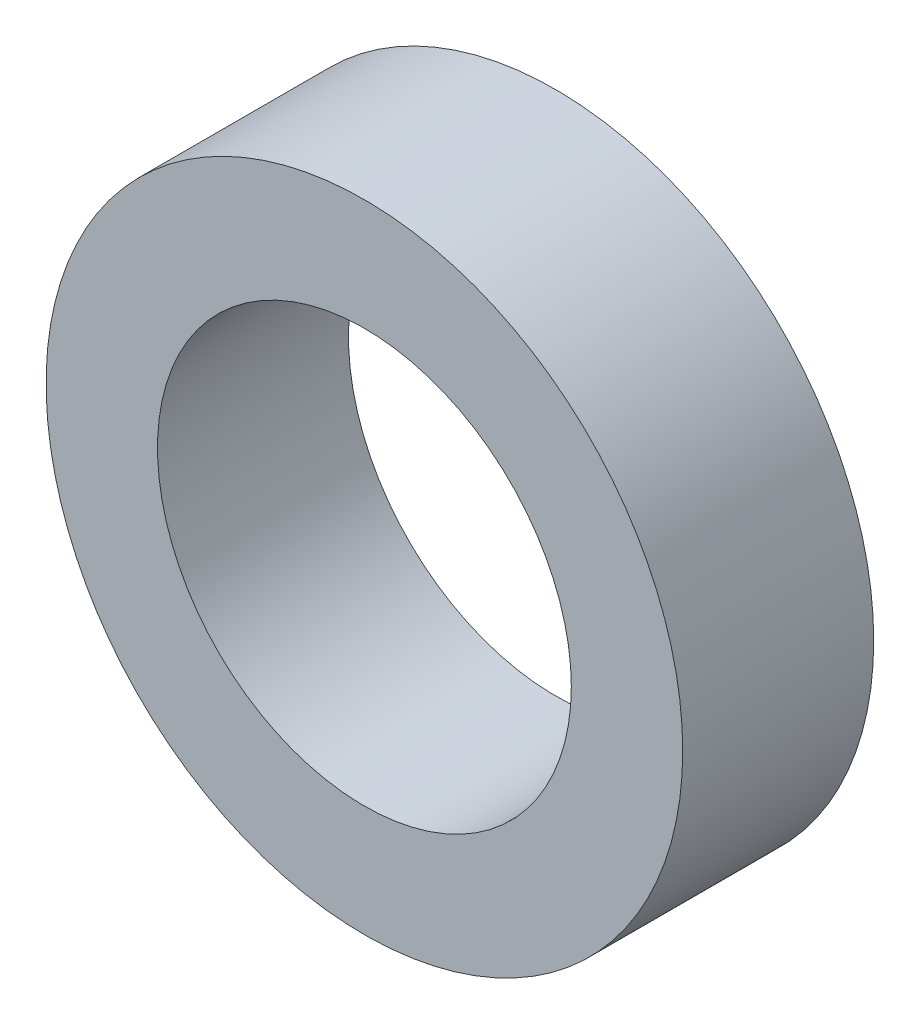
SolidWorks part; units mm, degrees
ref_plane "Front Plane" through (0, 0, 0) normal (0, 0, 1) x (1, 0, 0)
ref_plane "Top Plane" through (0, 0, 0) normal (0, 1, 0) x (1, 0, 0)
ref_plane "Right Plane" through (0, 0, 0) normal (1, 0, 0) x (0, 0, -1)
sketch "Sketch1" plane through (0, 0, 0) normal (0, 0, 1) x (1, 0, 0)
  circle A0 centre (0, 0) radius 5
  dimension "D1" = 10
extrude "Boss-Extrude1" add sketch "Sketch1" along normal blind 3
sketch "Sketch2" plane through (0, 0, 3) normal (0, 0, 1) x (1, 0, 0)
  circle A0 centre (0, 0) radius 3.25
  dimension "D1" = 6.5
extrude "Cut-Extrude1" cut sketch "Sketch2" against normal blind 3
